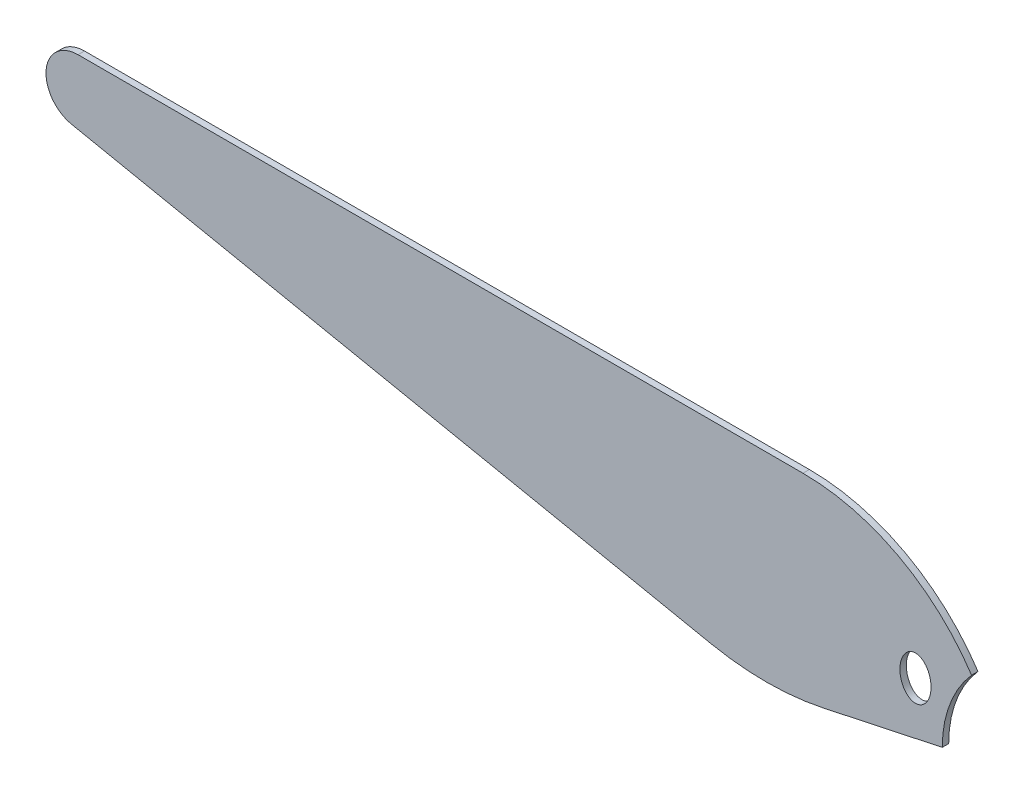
SolidWorks part; units mm, degrees
ref_plane "Plan de face" through (0, 0, 0) normal (0, 0, 1) x (1, 0, 0)
ref_plane "Plan de dessus" through (0, 0, 0) normal (0, 1, 0) x (1, 0, 0)
ref_plane "Plan de droite" through (0, 0, 0) normal (1, 0, 0) x (0, 0, -1)
sketch "Esquisse1" plane through (0, 0, 0) normal (0, 0, 1) x (1, 0, 0)
  line L0 (0, 5) -> (112.9325, 5)
  line L1 (-0.9968, -4.8996) -> (98.6165, -25.1662)
  line L2 (134.6357, -21.1369) -> (116.1457, -25.0826)
  arc A0 (0, 5) -> (-0.9968, -4.8996) centre (0, 0) ccw
  arc A1 (112.9325, 5) -> (139.202, -9.1172) centre (112.9325, -26.5) cw
  arc A2 (139.202, -9.1172) -> (134.6357, -21.1369) centre (152.7351, -21.1358) ccw
  arc A4 (98.6165, -25.1662) -> (116.1457, -25.0826) centre (107.1806, 16.9278) ccw
  dimension "D1" = 5
  dimension "D2" = 31.5
  dimension "D4" = 11.5
extrude "Boss.-Extru.1" add sketch "Esquisse1" along normal blind 1
sketch "Esquisse2" plane through (0, 0, 1) normal (0, 0, 1) x (1, 0, 0)
  ellipse E0 centre (130.4603, -13.8857) end of major axis (130.4603, -17.2803) minor radius 2.4213
extrude "Enlèv. mat.-Extru.1" cut sketch "Esquisse2" against normal through all
